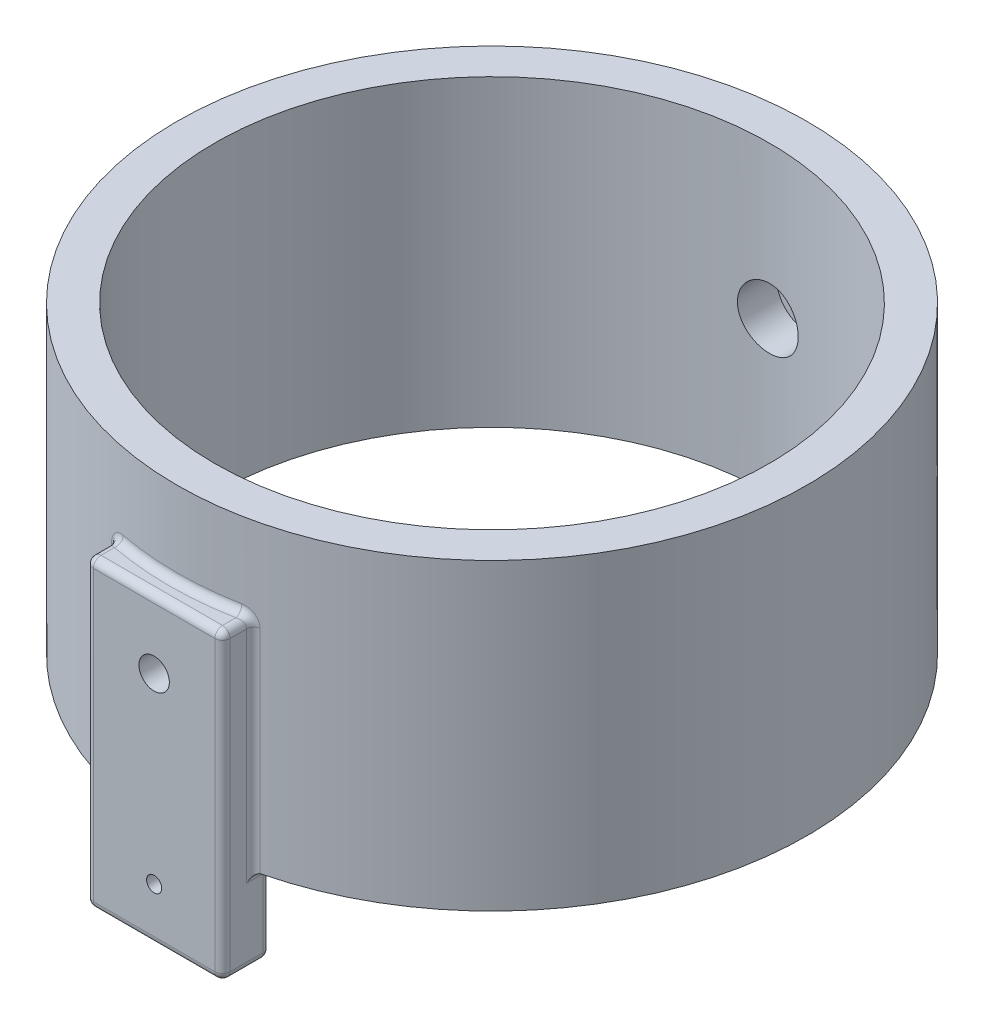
SolidWorks part; units mm, degrees
ref_plane "Front Plane" through (0, 0, 0) normal (0, 0, 1) x (1, 0, 0)
ref_plane "Top Plane" through (0, 0, 0) normal (0, 1, 0) x (1, 0, 0)
ref_plane "Right Plane" through (0, 0, 0) normal (1, 0, 0) x (0, 0, -1)
sketch "Sketch1" plane through (0, 0, 0) normal (0, 1, 0) x (1, 0, 0)
  line L0 (-42.1342, 0) -> (49.266, 0) construction
  line L1 (0, 38.3337) -> (0, -40.9612) construction
  line L2 (0, 38.3337) -> (-9, 38.3337) construction
  line L3 (0, 38.3337) -> (9, 38.3337) construction
  line L4 (-9, 38.3337) -> (-9, 40.5123) construction
  line L5 (9, 38.3337) -> (9, 40.5123) construction
  line L7 (9, 40.5123) -> (9, 44.5)
  line L8 (9, 44.5) -> (-9, 44.5)
  line L9 (-9, 40.5123) -> (-9, 44.5)
  line L10 (-41.5, 0) -> (41.5, 0)
  circle A1 centre (0, 0) radius 41.5 construction
  arc A2 (-9, 40.5123) -> (-41.5, 0) centre (0, 0) ccw
  arc A3 (9, 40.5123) -> (41.5, 0) centre (0, 0) cw
  arc A4 (-36.55, 0) -> (36.55, 0) centre (0, 0) cw
  dimension "D1" = 36.55
  dimension "D2" = 83
  dimension "D3" = 44.5
  dimension "D4" = 9
extrude "Boss-Extrude1" add sketch "Sketch1" along normal blind 40 contours L10 A4 A3 L7 L8 L9 A2
sketch "Sketch5" plane through (0, 0, 0) normal (0, -1, 0) x (1, 0, 0)
  circle A0 centre (0, 0) radius 41.5
  circle A1 centre (0, 0) radius 45.401
extrude "Cut-Extrude2" cut sketch "Sketch5" against normal blind 11
sketch "Sketch6" plane through (0, 40, 0) normal (0, 1, 0) x (1, 0, 0)
  circle A1 centre (0, 0) radius 45.401
  circle A2 centre (0, 0) radius 41.5
extrude "Cut-Extrude3" cut sketch "Sketch6" against normal blind 11
ref_plane "Plane3" through (0, 0, -41.5) normal (0, 0, -1) x (-1, 0, 0)
sketch "Sketch7" plane through (0, 0, -41.5) normal (0, 0, -1) x (-1, 0, 0)
  circle A0 centre (0, 20) radius 4
  dimension "D1" = 8
extrude "Cut-Extrude4" cut sketch "Sketch7" against normal blind 7
sketch "Sketch8" plane through (0, 0, -41.5) normal (0, 0, 1) x (1, 0, 0)
  circle A0 centre (0, 20) radius 2
  dimension "D1" = 4
extrude "Cut-Extrude5" cut sketch "Sketch8" along normal through all both and the other way through all contours A0
mirror "Mirror1" about plane through (0, 40, 0) normal (0, 0, -1) of "Cut-Extrude5", "Boss-Extrude1", "Cut-Extrude2", "Cut-Extrude3", "Cut-Extrude4"
sketch "Sketch11" plane through (0, 11, 0) normal (0, -1, 0) x (1, 0, 0)
  line L0 (-9, 44.5) -> (9, 44.5)
  line L1 (9, 44.5) -> (9, 38.1634)
  line L2 (9, 38.1634) -> (-9, 38.1634)
  line L3 (-9, 38.1634) -> (-9, 44.5)
extrude "Boss-Extrude2" add sketch "Sketch11" along normal blind 22 contours L0 L1 L2 L3
sketch "Sketch12" plane through (0, 0, 44.5) normal (0, 0, 1) x (1, 0, 0)
  circle A0 centre (0, -4) radius 1
  circle A1 centre (0, 20) radius 2 construction
  dimension "D1" = 2
  dimension "D2" = 24
extrude "Cut-Extrude6" cut sketch "Sketch12" against normal through all
fillet "Fillet1" radius 1 29 edges at (9, 14.5, 40.5123) (-9, 14.5, 40.5123) (9, 9, 44.5) (-9, 9, 44.5) (-9, 29, 42.5062) (9, 29, 42.5062) (0, 29, 44.5) (0, 29, 41.5) (9, 0, 39.3379) (0, 0, 38.1634) (-9, 0, 39.3379) (-9, -11, 41.3317) (0, -11, 38.1634) (-9, -5.5, 38.1634) (9, -11, 41.3317) (9, -5.5, 38.1634) (0, -11, 44.5) (-9, 11, -42.5062) (0, 11, -41.5) (9, 11, -42.5062) (0, 11, -44.5) (-9, 20, -40.5123) (9, 20, -40.5123) (-9, 20, -44.5) (9, 20, -44.5) (0, 29, -41.5) (-9, 29, -42.5062) (9, 29, -42.5062) (0, 29, -44.5)
